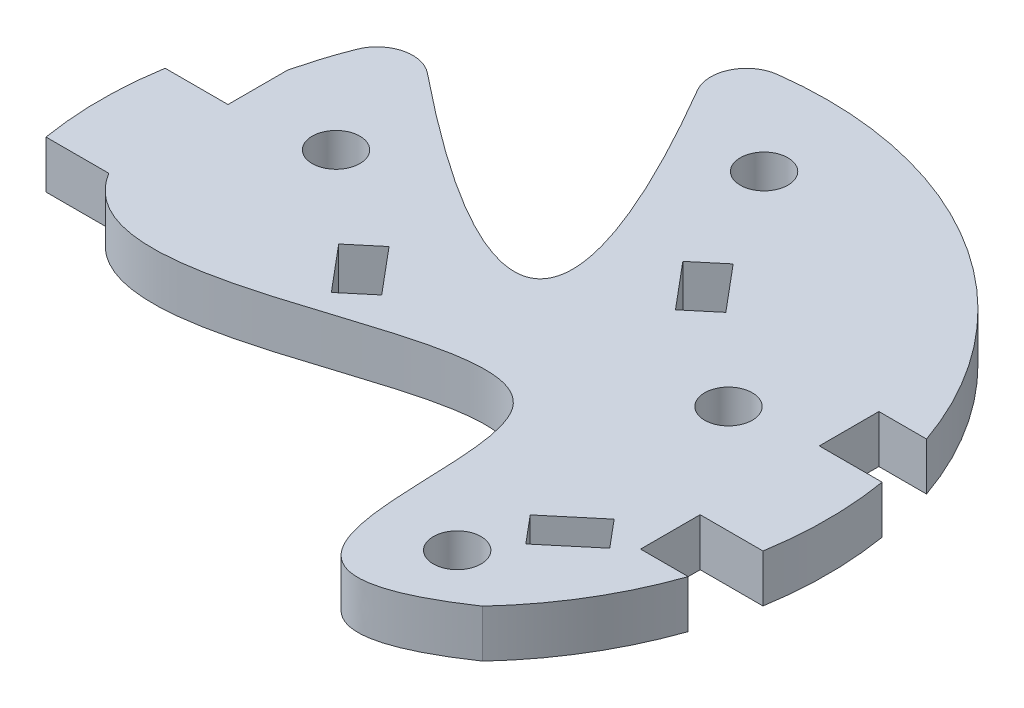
SolidWorks part; units mm, degrees
ref_plane "Alzado" through (0, 0, 0) normal (0, 0, 1) x (1, 0, 0)
ref_plane "Planta" through (0, 0, 0) normal (0, 1, 0) x (1, 0, 0)
ref_plane "Vista lateral" through (0, 0, 0) normal (1, 0, 0) x (0, 0, -1)
sketch "Croquis1" plane through (0, 0, 0) normal (0, 1, 0) x (1, 0, 0)
  circle A0 centre (0, 0) radius 30.5
extrude "Saliente-Extruir1" add sketch "Croquis1" along normal blind 4
sketch "Croquis5" plane through (0, 4, 0) normal (0, 1, 0) x (1, 0, 0)
  line L0 (0, 0) -> (0, 10)
  line L1 (28.8141, -5) -> (30.0874, -5)
  line L2 (28.8141, 5) -> (30.0874, 5)
  line L3 (-24.8141, 10) -> (-28.8141, 10)
  line L4 (24.8141, -5) -> (24.8141, -10)
  line L5 (-24.8141, -10) -> (-28.8141, -10)
  line L6 (24.8141, -5) -> (28.8141, -5)
  line L7 (24.8141, 5) -> (24.8141, 10)
  line L8 (-24.8141, 5) -> (-28.8141, 5)
  line L9 (-24.8141, 5) -> (-24.8141, 10)
  line L10 (-24.8141, -5) -> (-28.8141, -5)
  line L11 (-24.8141, -5) -> (-24.8141, -10)
  line L12 (24.8141, 5) -> (28.8141, 5)
  line L13 (24.8141, -10) -> (28.8141, -10)
  line L14 (24.8141, 10) -> (28.8141, 10)
  line L15 (-28.8141, 5) -> (-30.0874, 5)
  line L16 (-28.8141, -5) -> (-30.0874, -5)
  circle A1 centre (0, 0) radius 30.5 construction
  arc A2 (-28.8141, 10) -> (-30.0874, 5) centre (0, 0) ccw
  arc A3 (28.8141, 10) -> (28.8141, -10) centre (0, 0) cw
  arc A4 (-30.0874, -5) -> (-28.8141, -10) centre (0, 0) ccw
  arc A5 (30.0874, -5) -> (28.8141, -10) centre (0, 0) cw
  arc A6 (28.8141, 10) -> (30.0874, 5) centre (0, 0) cw
extrude "Cortar-Extruir3" cut sketch "Croquis5" against normal blind 4
sketch "Croquis9" plane through (0, 4, 0) normal (0, 1, 0) x (1, 0, 0)
  line L0 (7.2803, 10.7703) -> (22.8679, -7.8063)
  line L1 (-8.3073, 29.3469) -> (7.2803, 10.7703)
  line L2 (7.9714, 14.6138) -> (11.1854, 10.7835)
  line L3 (-24.8141, -5) -> (-24.8141, -10)
  line L4 (-24.8141, -10) -> (-28.8141, -10)
  line L5 (11.1854, 10.7835) -> (8.8872, 8.8552)
  line L6 (-7.7325, 1.4366) -> (-10.0306, -0.4918)
  line L7 (7.9714, 14.6138) -> (5.6733, 12.6854)
  line L8 (-10.0306, -0.4918) -> (-6.8167, -4.322)
  line L9 (-6.8167, -4.322) -> (-4.5186, -2.3936)
  line L10 (21.5273, -8.9312) -> (23.4556, -11.2293)
  line L13 (-24.8141, 10) -> (-28.8141, 10)
  line L20 (-7.7325, 1.4366) -> (-4.5186, -2.3936)
  line L21 (17.6971, -12.1451) -> (19.6254, -14.4432)
  line L23 (19.6254, -14.4432) -> (23.4556, -11.2293)
  line L27 (17.6971, -12.1451) -> (21.5273, -8.9312)
  circle A0 centre (2.5506, 22.6297) radius 2
  arc A1 (28.8141, 10) -> (-28.8141, 10) centre (0, 0) ccw construction
  circle A2 centre (18.1382, 4.0531) radius 2
  circle A4 centre (-16.9835, 6.2386) radius 2
  arc A5 (-28.8141, -10) -> (28.8141, -10) centre (0, 0) ccw construction
  arc A6 (-23.4189, 14.4323) -> (-18.7453, 15.6646) centre (-20.6289, 13.3296) cw
  arc A7 (-28.8141, -10) -> (22.3289, -20.7766) centre (0, 0) ccw
  arc A8 (-28.8141, 10) -> (-8.3073, 29.3469) centre (0, 0) cw
  circle A9 centre (17.204, -17.7804) radius 2
  spline S0 degree 3 poles (22.3289, -20.7766) (5.9738, -31.8512) (22.1768, 15.8352) (-18.2069, -15.8076) (-24.8141, -5) knots 0 0 0 0 0.44579 1 1 1 1
  spline S1 degree 3 poles (-24.8141, -5) (-26.3603, 1.5896) (-25.8363, 8.3159) (-23.4189, 14.4323) knots 0 0 0 0 0.831813 0.831813 0.831813 0.831813
  spline S2 degree 3 poles (-18.7453, 15.6646) (3.867, -2.5765) (8.0942, 2.4964) (-8.3073, 29.3469) knots 0.040528 0.040528 0.040528 0.040528 1 1 1 1
  dimension "D1" = 3
extrude "Cortar-Extruir6" cut sketch "Croquis9" against normal blind 10
fillet "Redondeo1" radius 3 1 edges at (-8.3073, 2, -29.3469)
